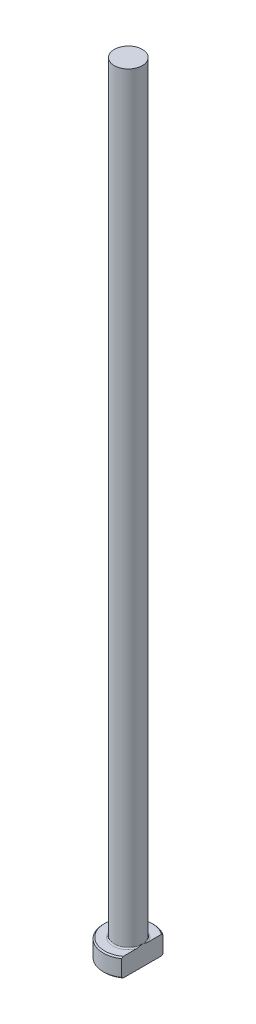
SolidWorks part; units mm, degrees
ref_plane "Front Plane" through (0, 0, 0) normal (0, 0, 1) x (1, 0, 0)
ref_plane "Top Plane" through (0, 0, 0) normal (0, 1, 0) x (1, 0, 0)
ref_plane "Right Plane" through (0, 0, 0) normal (1, 0, 0) x (0, 0, -1)
sketch "Sketch1" plane through (0, 0, 0) normal (0, 0, 1) x (1, 0, 0)
  line L0 (0, 259.9588) -> (0, -15.1925) construction
  line L1 (0, 0) -> (-4, 0)
  line L2 (-4, 0) -> (-4, 3)
  line L3 (-4, 3) -> (-2.25, 3)
  line L4 (-2.25, 3) -> (-2.25, 125)
  line L5 (-2.25, 125) -> (0, 125)
  line L6 (0, 125) -> (0, 0)
  dimension "L" = 125
  dimension "H" = 8
  dimension "T" = 3
  dimension "D" = 4.5
revolve "Revolve1" add sketch "Sketch1" angle 360 about L0
chamfer "Chamfer1" distance 0.2 angle 45 2 edges at (0, 3, 4) (0, 0, 4)
fillet "Fillet1" radius 0.2 1 edges at (0, 3, 2.25)
sketch "Sketch2" plane through (0, 0, 0) normal (0, 1, 0) x (1, 0, 0)
  line L0 (2.25, 3.3072) -> (2.25, -3.3072)
  circle A0 centre (0, 0) radius 4 construction
  arc A1 (2.25, -3.3072) -> (2.25, 3.3072) centre (0, 0) ccw
  circle A2 centre (0, 0) radius 2.25 construction
extrude "KEY" cut sketch "Sketch2" along normal through all
